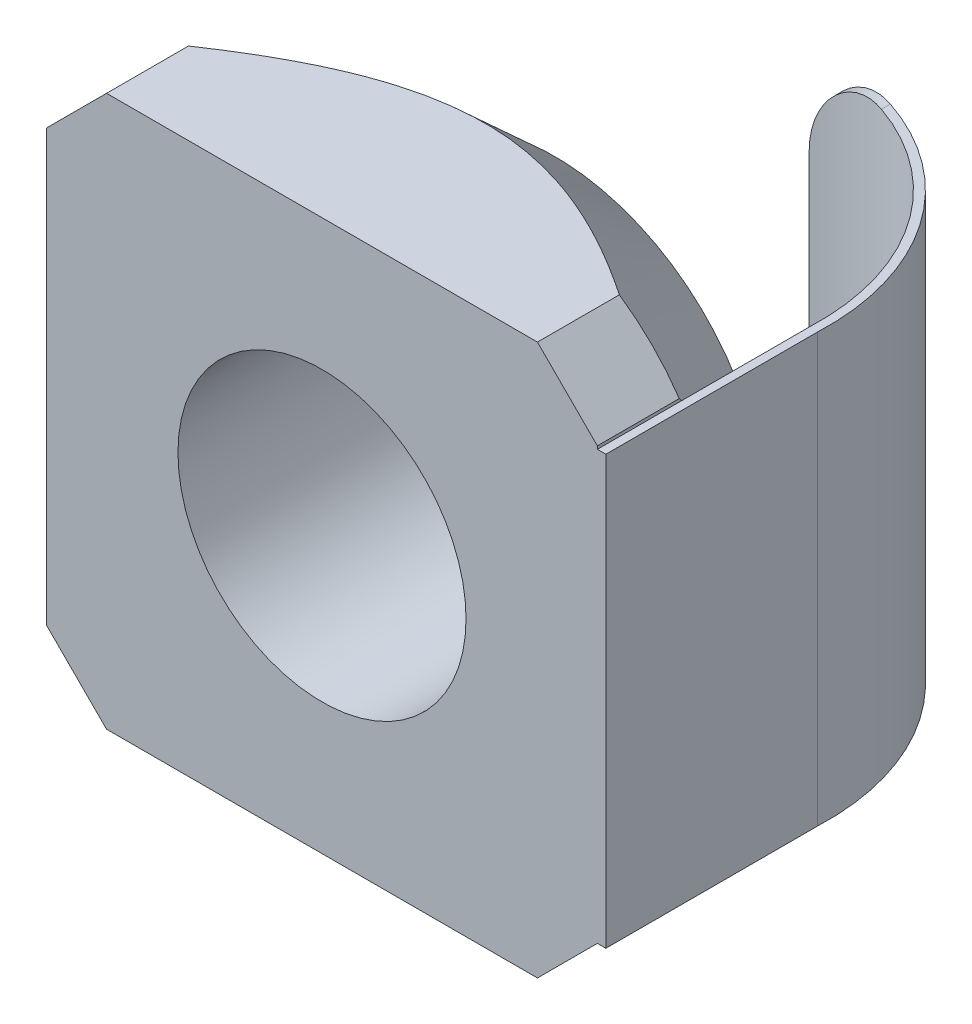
SolidWorks part; units mm, degrees
ref_plane "Front" through (0, 0, 0) normal (0, 0, 1) x (1, 0, 0)
ref_plane "Top" through (0, 0, 0) normal (0, 1, 0) x (1, 0, 0)
ref_plane "Right" through (0, 0, 0) normal (1, 0, 0) x (0, 0, -1)
imported_body "Imported1"
hole_wizard "M8x1.25 Tapped Hole1" positions "3DSketch1" profile "Sketch1" tap size "M8x1.25" standard "Ansi Metric"
sketch3d "3DSketch1"
  line L0 (-6.5, 5.0858, 0) -> (-6.5, -5.0858, 0) construction
  line L1 (5.0858, 6.5, 0) -> (-5.0858, 6.5, 0) construction
  point P0 (0, 0, 0)
  dimension "D1" = 6.5
  dimension "D2" = 6.5
sketch "Sketch1" plane through (0, 0, 0) normal (1, 0, 0) x (0, -1, 0)
  line L0 (0, 0) -> (0, 8.0429)
  line L1 (0, 8.0429) -> (3.4, 6)
  line L2 (3.4, 6) -> (3.4, 0)
  line L5 (3.4, 0) -> (0, 0)
  line L10 (0, 8.0429) -> (-3.4, 6) construction
  line L11 (0, -6.35) -> (0, 107.95) construction
  dimension "Tap Drill Dia." = 6.8
  dimension "Tap Drill Depth" = 6
  dimension "Drill Angle" = 118
